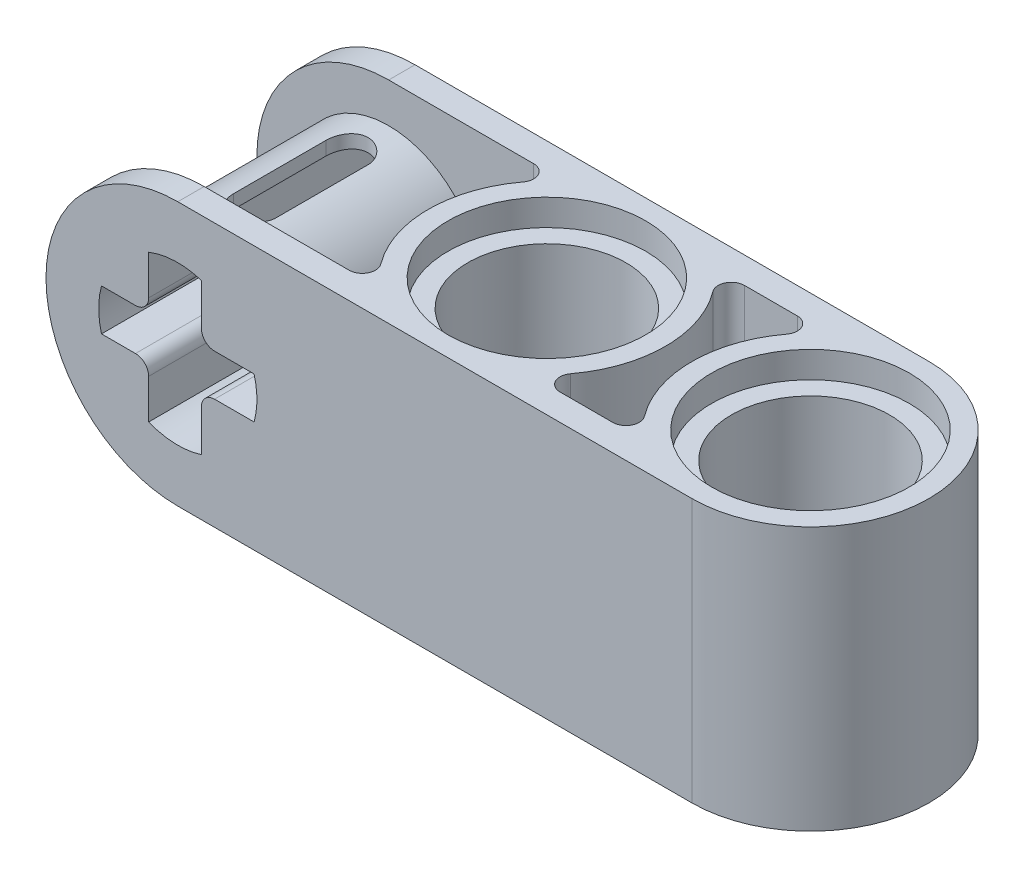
SolidWorks part; units mm, degrees
ref_plane "정면" through (0, 0, 0) normal (0, 0, 1) x (1, 0, 0)
ref_plane "윗면" through (0, 0, 0) normal (0, 1, 0) x (1, 0, 0)
ref_plane "우측면" through (0, 0, 0) normal (1, 0, 0) x (0, 0, -1)
sketch "스케치1" plane through (0, 0, 0) normal (0, 1, 0) x (1, 0, 0)
  line L1 (-8, -3.6) -> (8, -3.6)
  line L3 (-8, 3.6) -> (8, 3.6)
  line L5 (-8, -3.6) -> (8, 3.6) construction
  line L6 (-8, 3.6) -> (8, -3.6) construction
  arc A0 (-8, 3.6) -> (-8, -3.6) centre (-8, 0) ccw
  arc A1 (8, -3.6) -> (8, 3.6) centre (8, 0) ccw
  point P0 (0, 0)
  dimension "D2" = 3.6
  dimension "D1" = 16
extrude "보스-돌출1" add sketch "스케치1" along normal mid plane 8
sketch "스케치2" plane through (0, 0, 0) normal (0, 1, 0) x (1, 0, 0)
  circle A0 centre (0, 0) radius 2.4
  circle A1 centre (8, 0) radius 2.4
  dimension "D1" = 4.8
  dimension "D2" = 4.8
extrude "컷-돌출1" cut sketch "스케치2" against normal through all both and the other way through all
sketch "스케치3" plane through (0, 4, 0) normal (0, 1, 0) x (1, 0, 0)
  circle A0 centre (0, 0) radius 3
  circle A1 centre (8, 0) radius 3
  dimension "D1" = 6
  dimension "D2" = 6
extrude "컷-돌출2" cut sketch "스케치3" against normal blind 0.8
sketch "스케치4" plane through (0, 0, 0) normal (0, 0, 1) x (1, 0, 0)
  line L0 (-11.6, 4) -> (-11.6, -4) construction
  circle A0 centre (-7.6, 0) radius 4
  dimension "D1" = 8
  dimension "D2" = 7.6
extrude "보스-돌출2" add sketch "스케치4" along normal mid plane 7.2
sketch "스케치5" plane through (0, 0, 0) normal (0, 0, 1) x (1, 0, 0)
  line L0 (-7.6, 4) -> (-11.6, 4)
  line L1 (-11.6, 4) -> (-11.6, 0)
  line L2 (-11.6, 0) -> (-11.6, -4)
  line L3 (-11.6, 0) -> (-11.6, -4) construction
  line L4 (-11.6, -4) -> (-7.6, -4)
  arc A1 (-7.6, 4) -> (-7.6, -4) centre (-7.6, 0) ccw
extrude "컷-돌출3" cut sketch "스케치5" against normal through all both and the other way through all contours A1 L0 L1 | A1 L2 L4
sketch "스케치7" plane through (0, 4, 0) normal (0, 1, 0) x (1, 0, 0)
  line L0 (4.8, 2.8) -> (3.2, 2.8)
  line L1 (3.2, -2.8) -> (4.8, -2.8)
  line L2 (-3.2, 2.8) -> (-11.6, 2.8)
  line L3 (-11.6, -2.8) -> (-3.2, -2.8)
  line L4 (-11.6, 3.6) -> (-11.6, -3.6) construction
  line L5 (-11.6, -2.8) -> (-11.6, 2.8)
  arc A0 (5.12, 2.16) -> (4.8, 2.8) centre (4.8, 2.4) ccw
  arc A1 (3.2, 2.8) -> (2.88, 2.16) centre (3.2, 2.4) ccw
  arc A2 (2.88, 2.16) -> (2.88, -2.16) centre (0, 0) cw
  arc A3 (2.88, -2.16) -> (3.2, -2.8) centre (3.2, -2.4) ccw
  arc A4 (4.8, -2.8) -> (5.12, -2.16) centre (4.8, -2.4) ccw
  arc A5 (5.12, -2.16) -> (5.12, 2.16) centre (8, 0) cw
  circle A6 centre (8, 0) radius 3 construction
  circle A7 centre (0, 0) radius 3 construction
  arc A8 (-2.88, 2.16) -> (-3.2, 2.8) centre (-3.2, 2.4) ccw
  arc A12 (-3.2, -2.8) -> (-2.88, -2.16) centre (-3.2, -2.4) ccw
  arc A13 (-2.88, -2.16) -> (-2.88, 2.16) centre (0, 0) cw
extrude "컷-돌출5" cut sketch "스케치7" against normal blind 3.2
mirror "대칭 복사1" about plane through (0, 0, 0) normal (0, 1, 0) of "컷-돌출5", "컷-돌출2"
sketch "스케치8" plane through (0, 0, 0) normal (0, 0, 1) x (1, 0, 0)
  circle A0 centre (-7.6, 0) radius 2.8
  dimension "D1" = 5.6
extrude "보스-돌출3" add sketch "스케치8" along normal mid plane 7.2 contours A0
sketch "스케치6" plane through (0, 0, 0) normal (0, 0, 1) x (1, 0, 0)
  line L0 (-6.8845, 0.6311) -> (-5.2845, 0.6311)
  line L1 (-6.8845, -0.6311) -> (-5.2845, -0.6311)
  line L2 (-8.4845, -2.2311) -> (-8.4845, -0.6311)
  line L3 (-8.4845, 0.6311) -> (-8.4845, 2.2311)
  line L4 (-6.8845, -2.2909) -> (-6.8845, -0.6311)
  line L7 (-9.9155, -0.6311) -> (-8.4845, -0.6311)
  line L8 (-6.8845, 0.6311) -> (-6.8845, 2.2909)
  line L9 (-9.9155, 0.6311) -> (-8.4845, 0.6311)
  arc A0 (-9.9155, 0.6311) -> (-9.9155, -0.6311) centre (-7.6, 0) ccw
  arc A1 (-6.8845, 2.2909) -> (-8.4845, 2.2311) centre (-7.6, 0) ccw
  arc A2 (-5.2845, -0.6311) -> (-5.2845, 0.6311) centre (-7.6, 0) ccw
  arc A3 (-8.4845, -2.2311) -> (-6.8845, -2.2909) centre (-7.6, 0) ccw
  dimension "D1" = 4.8
  dimension "D2" = 1.6
  dimension "D3" = 1.6
  dimension "D4" = 1.6
  dimension "D5" = 1.6
extrude "컷-돌출4" cut sketch "스케치6" against normal through all both and the other way through all contours L3 A1 L8 L0 A2 L1 L4 A3 L2 L7 A0 L9
sketch "스케치9" plane through (0, 0, 0) normal (0, 1, 0) x (1, 0, 0)
  line L0 (-7.6, -1.2648) -> (-7.6, 1.5352) construction
  line L1 (-8.24, -1.2648) -> (-8.24, 1.5352)
  line L2 (-6.96, -1.2648) -> (-6.96, 1.5352)
  arc A0 (-8.24, -1.2648) -> (-6.96, -1.2648) centre (-7.6, -1.2648) ccw
  arc A1 (-6.96, 1.5352) -> (-8.24, 1.5352) centre (-7.6, 1.5352) ccw
  point P2 (-7.6, 0.1352)
  dimension "D2" = 0.64
  dimension "D1" = 2.8
extrude "컷-돌출6" cut sketch "스케치9" against normal through all both and the other way through all
fillet "필렛1" radius 0.4 4 edges at (-8.4845, -0.6311, 0) (-6.8845, -0.6311, 0) (-6.8845, 0.6311, 0) (-8.4845, 0.6311, 0)
sketch "스케치11" plane through (0, 0, 0) normal (0, 0, 1) x (1, 0, 0)
  line L1 (-11.4461, -1.099) -> (-10.1753, -1.099)
  line L2 (-11.4419, 1.1136) -> (-10.169, 1.1136)
  arc A0 (-10.169, 1.1136) -> (-10.1753, -1.099) centre (-7.6, 0) ccw
  arc A1 (-11.4419, 1.1136) -> (-11.4461, -1.099) centre (-7.6, 0) ccw
  arc A2 (-7.6, 4) -> (-7.6, -4) centre (-7.6, 0) ccw construction
  dimension "D1" = 2.8
extrude "컷-돌출8" cut sketch "스케치11" against normal mid plane 5.6
